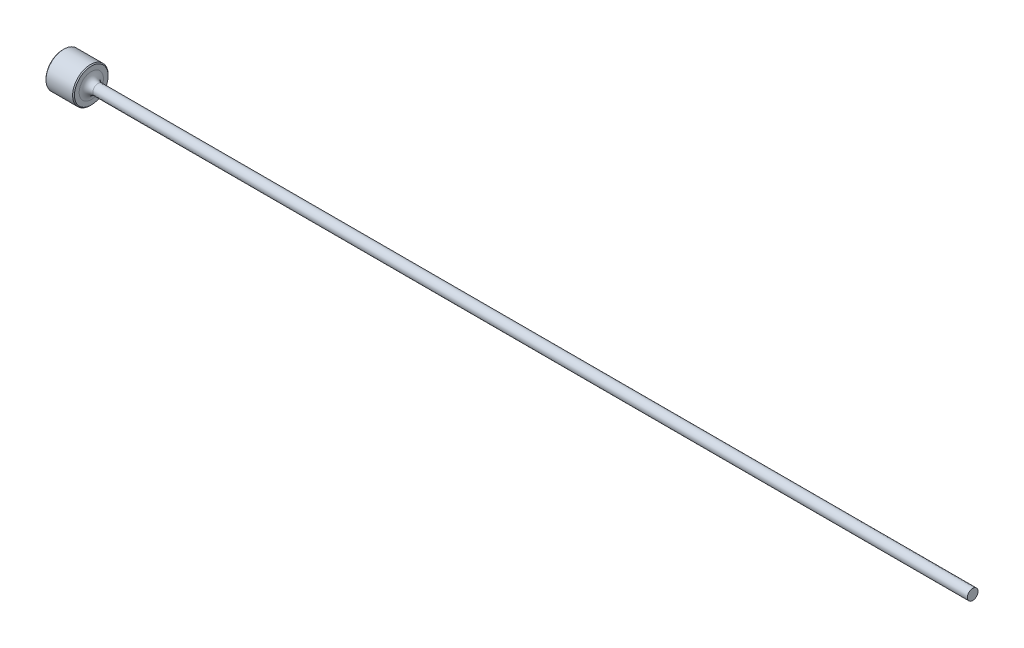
SolidWorks part; units mm, degrees
ref_plane "Front Plane" through (0, 0, 0) normal (0, 0, 1) x (1, 0, 0)
ref_plane "Top Plane" through (0, 0, 0) normal (0, 1, 0) x (1, 0, 0)
ref_plane "Right Plane" through (0, 0, 0) normal (1, 0, 0) x (0, 0, -1)
sketch "Sketch1" plane through (0, 0, 0) normal (0, 0, 1) x (1, 0, 0)
  line L0 (0, 0) -> (0, 1.9844)
  line L1 (0, 1.9844) -> (3.175, 1.9844)
  line L2 (3.175, 1.9844) -> (3.175, 1.3535)
  line L3 (3.937, 0.5915) -> (101.6, 0.5915)
  line L4 (101.6, 0.5915) -> (101.6, 0)
  line L5 (101.6, 0) -> (0, 0)
  line L6 (101.6, 0) -> (101.6, -0.5915) construction
  line L7 (101.6, -0.5915) -> (3.175, -0.5915) construction
  line L8 (0, 0) -> (0, -1.9844) construction
  line L9 (0, -1.9844) -> (3.175, -1.9844) construction
  line L10 (3.175, -1.9844) -> (3.175, -0.5915) construction
  arc A0 (3.175, 1.3535) -> (3.937, 0.5915) centre (3.937, 1.3535) ccw
  dimension "D4" = 0.762
  dimension "L" = 101.6
  dimension "D" = 1.183
  dimension "H" = 3.9688
  dimension "T" = 3.175
revolve "Revolve1" add sketch "Sketch1" angle 360 about L5
chamfer "Chamfer1" distance 0.1016 angle 45 2 edges at (0, 1.9844, 0) (3.175, 1.9844, 0)
